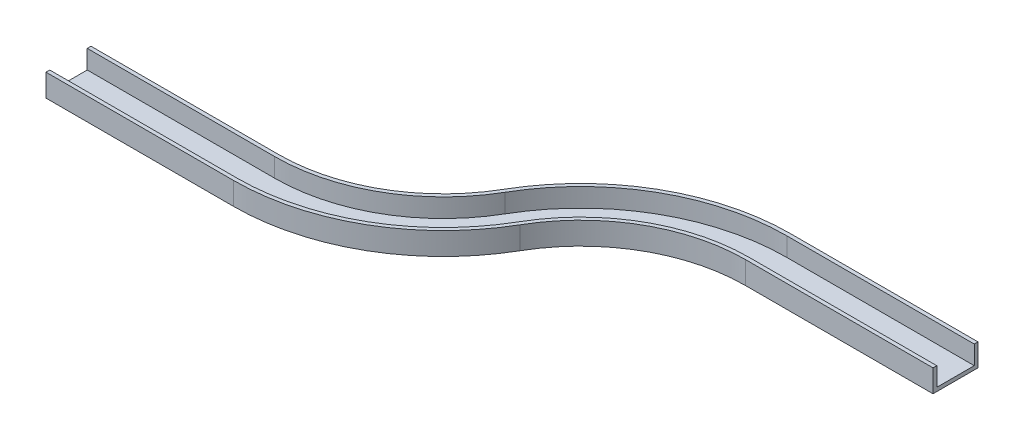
SolidWorks part; units mm, degrees
ref_plane "Vorne" through (0, 0, 0) normal (0, 0, 1) x (1, 0, 0)
ref_plane "Oben" through (0, 0, 0) normal (0, 1, 0) x (1, 0, 0)
ref_plane "Rechts" through (0, 0, 0) normal (1, 0, 0) x (0, 0, -1)
sketch "Skizze1" plane through (0, 0, 0) normal (0, 1, 0) x (1, 0, 0)
  line L0 (0, 0) -> (-500, 0)
  line L1 (866.0254, 500) -> (1366.0254, 500)
  arc A0 (0, 0) -> (433.0127, 250) centre (0, 500) ccw
  arc A1 (433.0127, 250) -> (866.0254, 500) centre (866.0254, 0) cw
  dimension "D4" = 500
  dimension "D1" = 60
  dimension "D2" = 60
  dimension "D3" = 500
ref_plane "Ebene1" through (1366.0254, 0, -500) normal (1, 0, 0) x (0, 0, -1)
sketch "Skizze2" plane through (1366.0254, 0, -500) normal (1, 0, 0) x (0, 0, -1)
  line L0 (-60, 50) -> (-60, -10)
  line L1 (-60, -10) -> (60, -10)
  line L2 (-50, 50) -> (-50, 0)
  line L3 (-50, 0) -> (50, 0)
  line L4 (50, 50) -> (50, 0)
  line L5 (60, 50) -> (60, -10)
  line L6 (-60, 50) -> (-50, 50)
  line L7 (50, 50) -> (60, 50)
  dimension "D1" = 100
  dimension "D2" = 50
  dimension "D3" = 10
sweep "Austragung1" add profiles "Skizze2" path "Skizze1"
